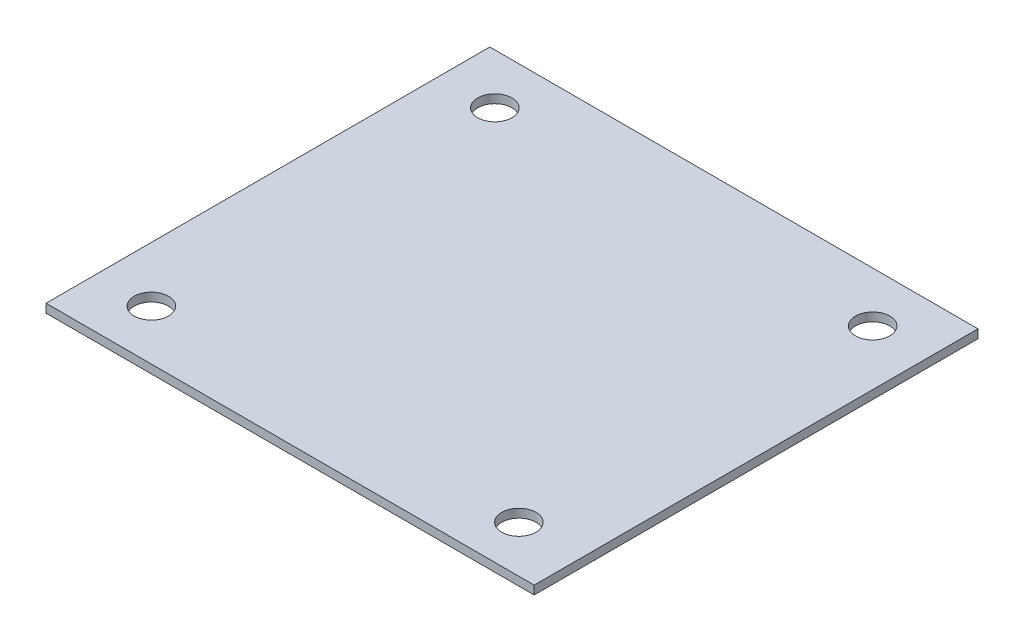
SolidWorks part; units mm, degrees
ref_plane "Front Plane" through (0, 0, 0) normal (0, 0, 1) x (1, 0, 0)
ref_plane "Top Plane" through (0, 0, 0) normal (0, 1, 0) x (1, 0, 0)
ref_plane "Right Plane" through (0, 0, 0) normal (1, 0, 0) x (0, 0, -1)
sketch "Sketch1" plane through (0, 0, 0) normal (0, 1, 0) x (1, 0, 0)
  line L1 (-71.0664, 64.6058) -> (71.0664, 64.6058)
  line L2 (-71.0664, 64.6058) -> (-71.0664, -64.6058)
  line L3 (-71.0664, -64.6058) -> (71.0664, -64.6058)
  line L4 (71.0664, 64.6058) -> (71.0664, -64.6058)
  line L5 (-71.0664, 64.6058) -> (71.0664, -64.6058) construction
  line L6 (-71.0664, -64.6058) -> (71.0664, 64.6058) construction
  circle A0 centre (-54.9984, -49.9986) radius 5
  circle A1 centre (53, -51) radius 5
  circle A2 centre (-55, 50) radius 5
  circle A4 centre (55, 50) radius 5
  point P0 (0, 0)
  point P8 (0, 0)
  point P13 (0, 0)
extrude "Boss-Extrude1" add sketch "Sketch1" against normal blind 2.5
